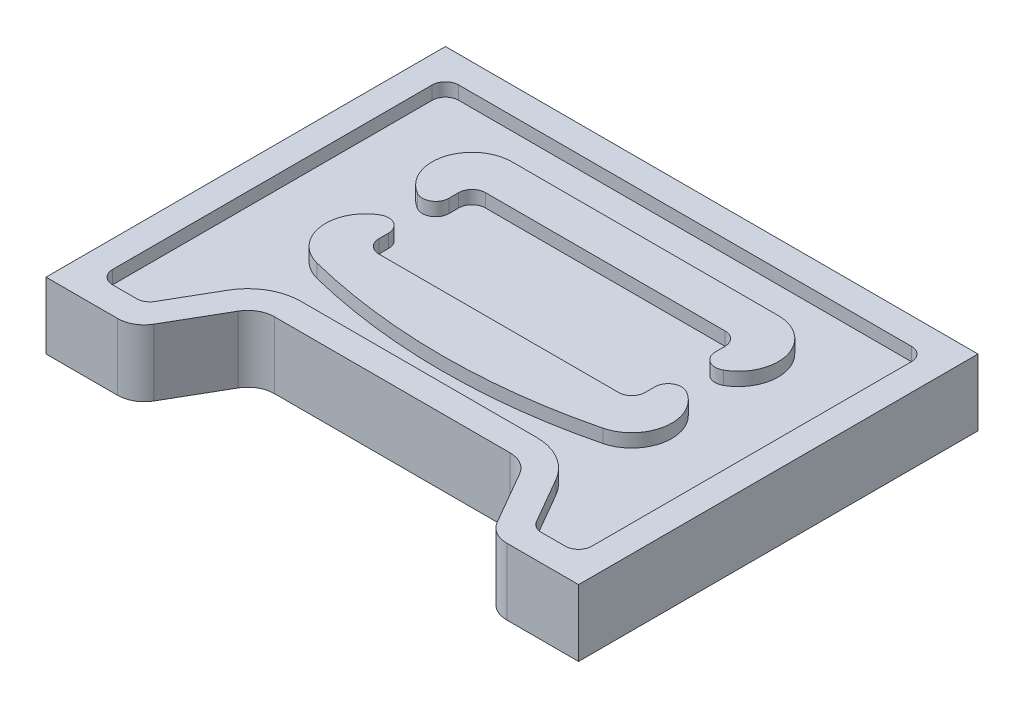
SolidWorks part; units mm, degrees
ref_plane "Front" through (0, 0, 0) normal (0, 0, 1) x (1, 0, 0)
ref_plane "Top" through (0, 0, 0) normal (0, 1, 0) x (1, 0, 0)
ref_plane "Right" through (0, 0, 0) normal (1, 0, 0) x (0, 0, -1)
sketch "Sketch1" plane through (0, 0, 0) normal (0, 1, 0) x (1, 0, 0)
  line L0 (-64.4338, -70) -> (-52.8868, -50)
  line L1 (-100, -75) -> (-73.094, -75)
  line L2 (-100, -75) -> (-100, 75)
  line L3 (-100, 75) -> (100, 75)
  line L4 (100, -75) -> (100, 75)
  line L5 (-100, -75) -> (100, 75) construction
  line L6 (-100, 75) -> (100, -75) construction
  line L7 (-44.2265, -45) -> (44.2265, -45)
  line L8 (52.8868, -50) -> (64.4338, -70)
  line L9 (0, 0) -> (0, -45) construction
  line L10 (73.094, -75) -> (100, -75)
  arc A0 (64.4338, -70) -> (73.094, -75) centre (73.094, -65) ccw
  arc A1 (44.2265, -45) -> (52.8868, -50) centre (44.2265, -55) cw
  arc A2 (-52.8868, -50) -> (-44.2265, -45) centre (-44.2265, -55) cw
  arc A3 (-73.094, -75) -> (-64.4338, -70) centre (-73.094, -65) ccw
  point P0 (0, 0)
  point P14 (0, -45)
  point P17 (67.3205, -75)
  point P20 (50, -45)
  point P23 (-50, -45)
  dimension "D7" = 10
  dimension "D1" = 200
  dimension "D2" = 150
  dimension "D3" = 100
  dimension "D4" = 120
  dimension "D5" = 120
  dimension "D6" = 30
extrude "Boss-Extrude1" add sketch "Sketch1" along normal blind 25
sketch "Sketch2" plane through (0, 25, 0) normal (0, 1, 0) x (1, 0, 0)
  line L16 (90, -65) -> (90, 65)
  line L17 (90, 65) -> (-90, 65)
  line L18 (-90, 65) -> (-90, -65)
  line L19 (-90, -65) -> (-73.094, -65)
  line L20 (-73.094, -65) -> (-61.547, -45)
  line L21 (-44.2265, -35) -> (44.2265, -35)
  line L22 (61.547, -45) -> (73.094, -65)
  line L23 (73.094, -65) -> (90, -65)
  line L24 (90, -60) -> (90, 60)
  line L25 (85, 65) -> (-85, 65)
  line L26 (-90, 60) -> (-90, -60)
  line L27 (-85, -65) -> (-75.9808, -65)
  line L28 (-71.6506, -62.5) -> (-61.547, -45)
  line L29 (-44.2265, -35) -> (44.2265, -35)
  line L30 (61.547, -45) -> (71.6506, -62.5)
  line L31 (75.9808, -65) -> (85, -65)
  arc A4 (71.6506, -62.5) -> (75.9808, -65) centre (75.9808, -60) ccw
  arc A5 (90, -60) -> (85, -65) centre (85, -60) cw
  arc A6 (90, 60) -> (85, 65) centre (85, 60) ccw
  arc A7 (-85, 65) -> (-90, 60) centre (-85, 60) ccw
  arc A8 (-44.2265, -35) -> (-61.547, -45) centre (-44.2265, -55) ccw
  arc A9 (61.547, -45) -> (44.2265, -35) centre (44.2265, -55) ccw
  arc A10 (-44.2265, -35) -> (-61.547, -45) centre (-44.2265, -55) ccw
  arc A11 (61.547, -45) -> (44.2265, -35) centre (44.2265, -55) ccw
  arc A12 (-75.9808, -65) -> (-71.6506, -62.5) centre (-75.9808, -60) ccw
  arc A13 (-90, -60) -> (-85, -65) centre (-85, -60) ccw
  dimension "D2" = 5
  dimension "D1" = 10
extrude "Cut-Extrude1" cut sketch "Sketch2" against normal blind 5
sketch "Sketch3" plane through (0, 20, 0) normal (0, 1, 0) x (1, 0, 0)
  line L0 (0, 65) -> (0, -35) construction
  line L1 (85, 65) -> (-85, 65) construction
  line L2 (-44.2265, -35) -> (44.2265, -35) construction
  line L3 (-50, 35) -> (50, 35) construction
  line L4 (-50, 50) -> (50, 50)
  line L6 (-50, -5) -> (50, -5) construction
  line L9 (-50, 35) -> (-50, 20) construction
  line L10 (50, 35) -> (50, 20) construction
  line L11 (-50, 10) -> (-50, -5) construction
  line L12 (-50, -5) -> (50, -5)
  line L13 (-50, -5) -> (-50, 3.6603)
  line L14 (-50, 35) -> (50, 35)
  line L15 (50, -5) -> (50, 3.6603)
  line L16 (-50, -5) -> (50, 35) construction
  line L17 (-50, 35) -> (50, -5) construction
  line L18 (-50, 26.3397) -> (-50, 35)
  line L19 (50, 10) -> (50, -5) construction
  line L20 (50, 26.3397) -> (50, 35)
  arc A0 (-50, 50) -> (-57.5, 22.0096) centre (-50, 35) ccw
  arc A1 (57.5, 22.0096) -> (50, 50) centre (50, 35) ccw
  arc A2 (-57.5, 7.9904) -> (-53.6362, -19.5526) centre (-50, -5) ccw
  arc A3 (53.6362, -19.5526) -> (57.5, 7.9904) centre (50, -5) ccw
  arc A4 (50, 3.6603) -> (57.5, 7.9904) centre (55, 3.6603) cw
  arc A5 (-50, 3.6603) -> (-57.5, 7.9904) centre (-55, 3.6603) ccw
  arc A6 (50, 26.3397) -> (57.5, 22.0096) centre (55, 26.3397) ccw
  arc A7 (-50, 26.3397) -> (-57.5, 22.0096) centre (-55, 26.3397) cw
  arc A8 (53.6362, -19.5526) -> (-53.6362, -19.5526) centre (0, 195.1099) cw
  point P8 (0, 35)
  point P14 (0, -5)
  point P20 (0, 15)
  point P25 (0, 15)
  dimension "D3" = 15
  dimension "D4" = 15
  dimension "D6" = 5
  dimension "D1" = 20
  dimension "D2" = 20
  dimension "D5" = 100
extrude "Boss-Extrude2" add sketch "Sketch3" along normal blind 5
sketch "Sketch4" plane through (0, 0, -75) normal (0, 0, -1) x (-1, 0, 0)
  line L0 (-100, 12.5) -> (100, 12.5) construction
  line L1 (-100, 25) -> (-100, 0) construction
  line L2 (100, 25) -> (100, 0) construction
  line L3 (-62.5, 12.5) -> (62.5, 12.5) construction
  line L4 (-62.5, 20.5) -> (62.5, 20.5)
  line L5 (-62.5, 4.5) -> (62.5, 4.5)
  arc A0 (-62.5, 20.5) -> (-62.5, 4.5) centre (-62.5, 12.5) ccw
  arc A1 (62.5, 4.5) -> (62.5, 20.5) centre (62.5, 12.5) ccw
  point P8 (0, 12.5)
  dimension "D2" = 8
  dimension "D1" = 125
extrude "Cut-Extrude2" cut sketch "Sketch4" against normal blind 3
fillet "Fillet1" radius 5 4 edges at (50, 22.5, 5) (-50, 22.5, 5) (-50, 22.5, -35) (50, 22.5, -35)
